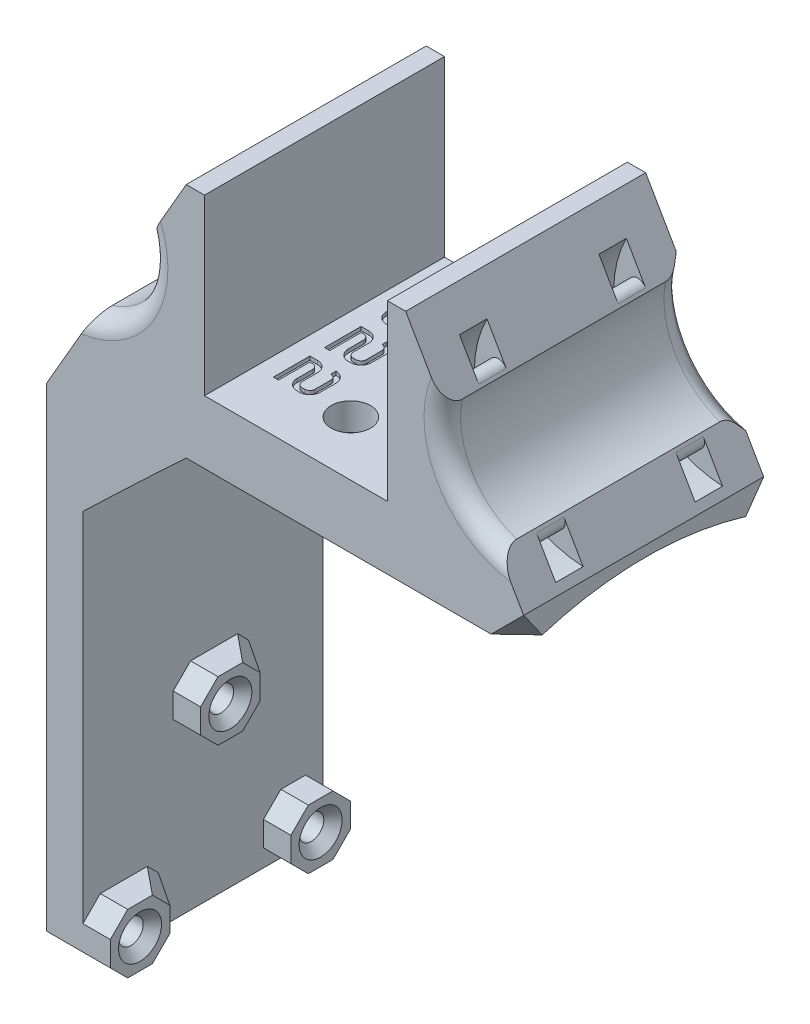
SolidWorks part; units mm, degrees
other "vostok_v9.0b3_assembly_id15176_x_b[1]"
ref_plane "Спереди" through (0, 0, 0) normal (0, 0, 1) x (1, 0, 0)
ref_plane "Сверху" through (0, 0, 0) normal (0, 1, 0) x (1, 0, 0)
ref_plane "Справа" through (0, 0, 0) normal (1, 0, 0) x (0, 0, -1)
other "Configuration Table"
imported_body "Импортированный1"
ref_plane "Плоскость1" through (0, 335.75, 0) normal (0, -1, 0) x (-1, 0, 0)
split "Разделить1" trim tools "Плоскость1" bodies to split 103 resulting bodies 104 105
ref_plane "Плоскость2" through (0, 325.75, 0) normal (0, -1, 0) x (-1, 0, 0)
move or copy body "Тело-Переместить/Копировать1" bodies to move or copy 104 placed by mates yes parameters "D1"=0, "D2"=0, "D3"=0
sketch "Эскиз2" plane through (0, 335.75, 0) normal (0, -1, 0) x (1, 0, 0)
  line L6 (247.7, 142.123) -> (242.7, 137.123)
  line L7 (242.7, 137.123) -> (242.7, 120.877)
  line L8 (242.7, 120.877) -> (247.7, 115.877)
  line L9 (247.7, 115.877) -> (251.7, 115.877)
  line L10 (251.7, 115.877) -> (251.7, 142.123)
  line L11 (251.7, 142.123) -> (247.7, 142.123)
  line L12 (247.7, 142.123) -> (242.7, 137.123)
  line L13 (242.7, 137.123) -> (242.7, 120.877)
  line L14 (242.7, 120.877) -> (247.7, 115.877)
  line L15 (247.7, 115.877) -> (251.7, 115.877)
  line L16 (251.7, 115.877) -> (251.7, 142.123)
  line L17 (251.7, 142.123) -> (247.7, 142.123)
  dimension "D1" = 0
extrude "Бобышка-Вытянуть1" add sketch "Эскиз2" along normal up to next
sketch "Эскиз3" plane through (254.7, 0, 0) normal (1, 0, 0) x (0, 0, -1)
  circle A0 centre (-129, 316.1006) radius 1.15
  circle A1 centre (-119.127, 299) radius 1.15
  circle A2 centre (-138.873, 299) radius 1.15
  dimension "D1" = 2.3
extrude "Вырез-Вытянуть1" cut sketch "Эскиз3" against normal through all
